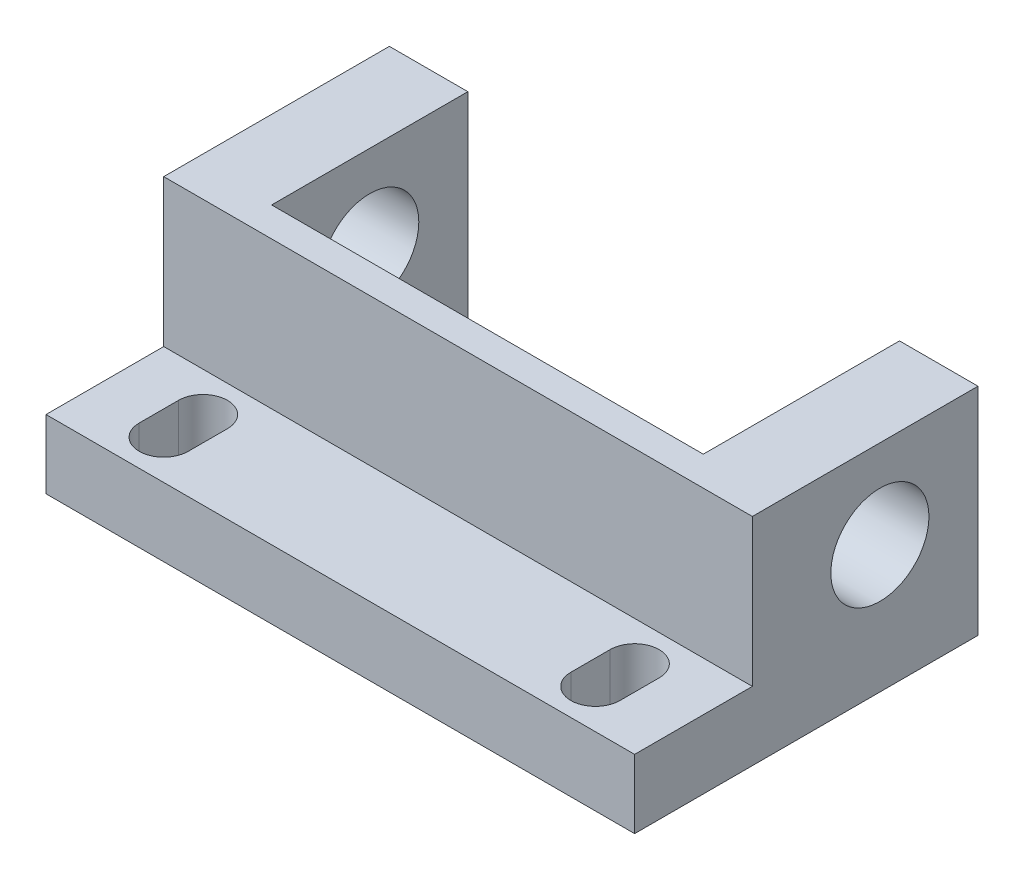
SolidWorks part; units mm, degrees
ref_plane "Front Plane" through (0, 0, 0) normal (0, 0, 1) x (1, 0, 0)
ref_plane "Top Plane" through (0, 0, 0) normal (0, 1, 0) x (1, 0, 0)
ref_plane "Right Plane" through (0, 0, 0) normal (1, 0, 0) x (0, 0, -1)
sketch "Sketch1" plane through (0, 0, 0) normal (1, 0, 0) x (0, 0, -1)
  line L1 (0, 0) -> (35, 0)
  line L2 (0, 0) -> (0, 22)
  line L3 (0, 22) -> (35, 22)
  line L4 (35, 0) -> (35, 22)
  dimension "D1" = 35
  dimension "D2" = 22
extrude "Boss-Extrude1" add sketch "Sketch1" along normal mid plane 60
sketch "Sketch2" plane through (0, 22, 0) normal (0, 1, 0) x (1, 0, 0)
  line L0 (30, 35) -> (-30, 35) construction
  line L1 (-22, 35) -> (22, 35)
  line L2 (-22, 35) -> (-22, 15)
  line L3 (-22, 15) -> (22, 15)
  line L4 (22, 35) -> (22, 15)
  line L5 (30, 35) -> (30, 0) construction
  line L6 (-30, 35) -> (-30, 0) construction
  dimension "D1" = 20
  dimension "D2" = 8
  dimension "D3" = 8
extrude "Cut-Extrude1" cut sketch "Sketch2" against normal through all
sketch "Sketch3" plane through (30, 0, 0) normal (1, 0, 0) x (0, 0, -1)
  line L0 (0, 0) -> (35, 0) construction
  line L1 (35, 0) -> (35, 22) construction
  circle A0 centre (25, 13) radius 5
  dimension "D1" = 10
  dimension "D2" = 13
  dimension "D3" = 10
extrude "Cut-Extrude2" cut sketch "Sketch3" against normal through all
sketch "Sketch4" plane through (30, 0, 0) normal (1, 0, 0) x (0, 0, -1)
  line L0 (0, 22) -> (0, 0) construction
  line L1 (0, 7) -> (12, 7)
  line L2 (0, 7) -> (0, 22)
  line L3 (0, 22) -> (12, 22)
  line L4 (12, 7) -> (12, 22)
  line L5 (35, 22) -> (0, 22) construction
  line L6 (0, 0) -> (35, 0) construction
  dimension "D1" = 7
  dimension "D2" = 12
extrude "Cut-Extrude3" cut sketch "Sketch4" against normal through all
sketch "Sketch5" plane through (0, 7, 0) normal (0, 1, 0) x (1, 0, 0)
  line L0 (-22, 4) -> (-22, 8) construction
  line L1 (-24.5, 4) -> (-24.5, 8)
  line L2 (-19.5, 4) -> (-19.5, 8)
  line L3 (-30, 0) -> (-30, 12) construction
  line L4 (-30, 0) -> (30, 0) construction
  line L5 (22, 4) -> (22, 8) construction
  line L6 (19.5, 4) -> (19.5, 8)
  line L7 (24.5, 4) -> (24.5, 8)
  line L8 (30, 0) -> (30, 12) construction
  arc A0 (-24.5, 4) -> (-19.5, 4) centre (-22, 4) ccw
  arc A1 (-19.5, 8) -> (-24.5, 8) centre (-22, 8) ccw
  arc A2 (19.5, 4) -> (24.5, 4) centre (22, 4) ccw
  arc A3 (24.5, 8) -> (19.5, 8) centre (22, 8) ccw
  point P2 (-22, 6)
  point P13 (22, 6)
  dimension "D3" = 4
  dimension "D1" = 8
  dimension "D2" = 5
  dimension "D4" = 4
  dimension "D5" = 8
  dimension "D6" = 5
  dimension "D7" = 4
  dimension "D8" = 4
extrude "Cut-Extrude4" cut sketch "Sketch5" against normal through all
